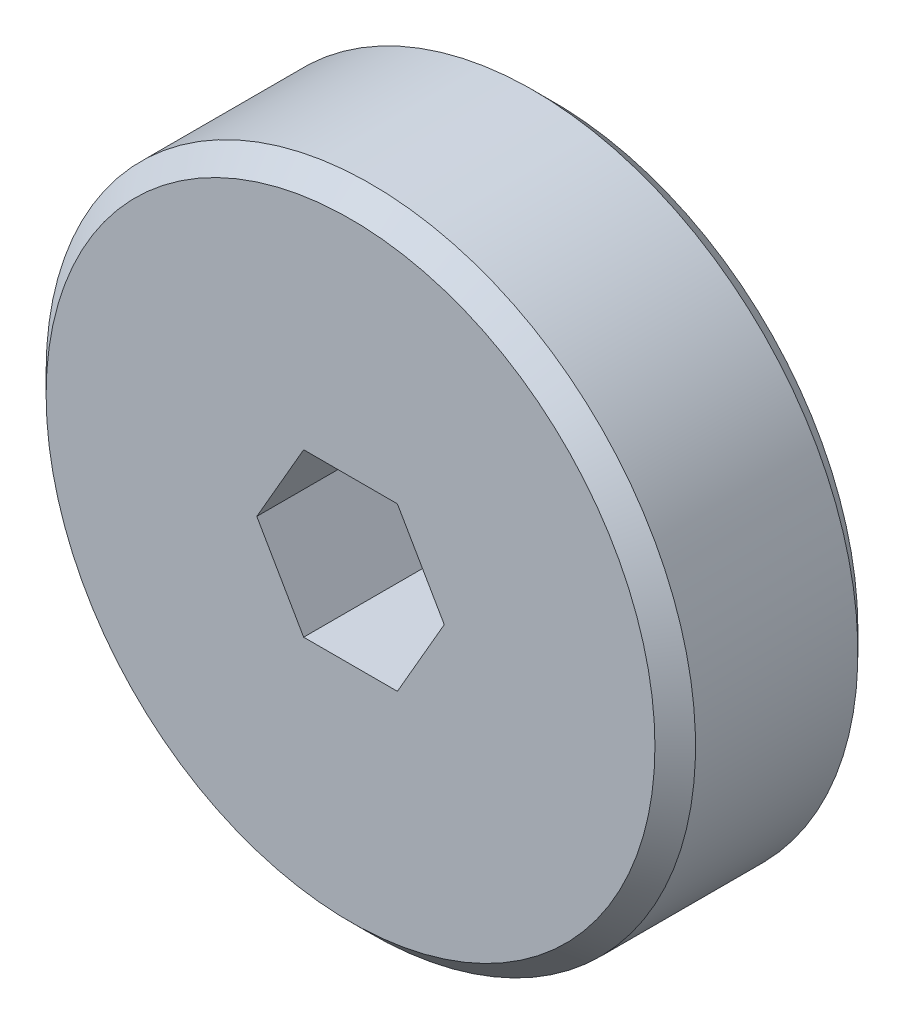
SolidWorks part; units mm, degrees
ref_plane "Front" through (0, 0, 0) normal (0, 0, 1) x (1, 0, 0)
ref_plane "Top" through (0, 0, 0) normal (0, 1, 0) x (1, 0, 0)
ref_plane "Right" through (0, 0, 0) normal (1, 0, 0) x (0, 0, -1)
sketch "Logo3_Revol_Axis" plane through (0, 0, 0) normal (0, 1, 0) x (1, 0, 0)
  line L0 (0, -43.5172) -> (0, 43.5172) construction
sketch "Logo3_bib1" plane through (0, 0, 0) normal (0, -1, 0) x (-1, 0, 0)
  line L0 (0, -7.9375) -> (0, 0)
  line L1 (0, 0) -> (11.9063, 0)
  line L5 (12.7, -7.1437) -> (11.9063, -7.9375)
  line L6 (11.9063, -7.9375) -> (0, -7.9375)
  line L8 (11.9063, 0) -> (12.7, -0.7937)
  line L9 (12.7, -0.7937) -> (12.7, -7.1437)
  line L10 (0, 10.5852) -> (0, -63.2873) construction
revolve "Revolve1" add sketch "Logo3_bib1" angle 360 about L10
sketch "Logo3_bib2" plane through (0, 0, 0) normal (0, 0, -1) x (1, 0, 0)
  line L1 (3.6662, 0) -> (1.8331, 3.175)
  line L2 (1.8331, 3.175) -> (-1.8331, 3.175)
  line L3 (-1.8331, 3.175) -> (-3.6662, 0)
  line L4 (-3.6662, 0) -> (-1.8331, -3.175)
  line L5 (-1.8331, -3.175) -> (1.8331, -3.175)
  line L6 (1.8331, -3.175) -> (3.6662, 0)
  circle A0 centre (0, 0) radius 3.175 construction
  dimension "Logo3_c1" = 6.35
extrude "Cut-Extrude1" cut sketch "Logo3_bib2" against normal through all
equation "\"D2@Cosmetic Thread1\" = \"Logo3_d1-pas@Logo3_bib1\""
